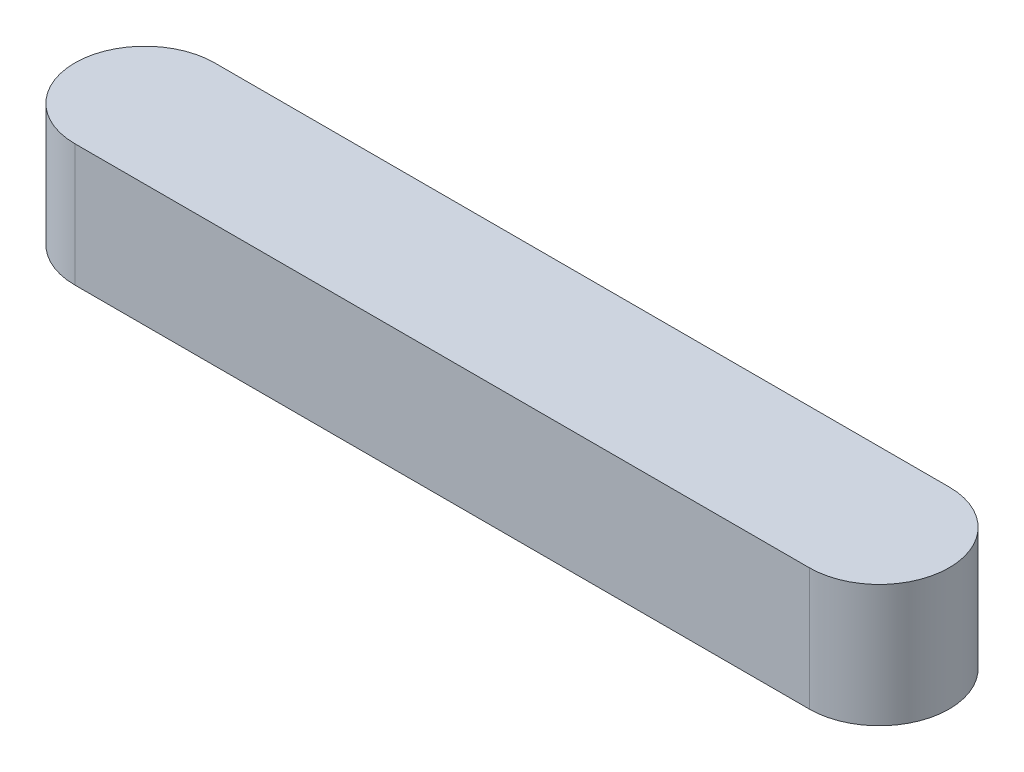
SolidWorks part; units mm, degrees
ref_plane "Спереди" through (0, 0, 0) normal (0, 0, 1) x (1, 0, 0)
ref_plane "Сверху" through (0, 0, 0) normal (0, 1, 0) x (1, 0, 0)
ref_plane "Справа" through (0, 0, 0) normal (1, 0, 0) x (0, 0, -1)
sketch "Sketch1" plane through (0, 0, 0) normal (0, 1, 0) x (1, 0, 0)
  line L0 (107.7099, 0) -> (-89.2202, 0) construction
  line L1 (42, 4) -> (0, 4)
  line L2 (0, -4) -> (42, -4)
  arc A0 (0, 4) -> (0, -4) centre (0, 0) ccw
  arc A1 (42, -4) -> (42, 4) centre (42, 0) ccw
  point P4 (-4, 0)
  point P6 (46, 0)
  dimension "D1" = 4
  dimension "D2" = 50
extrude "Extrude1" add sketch "Sketch1" along normal blind 7
